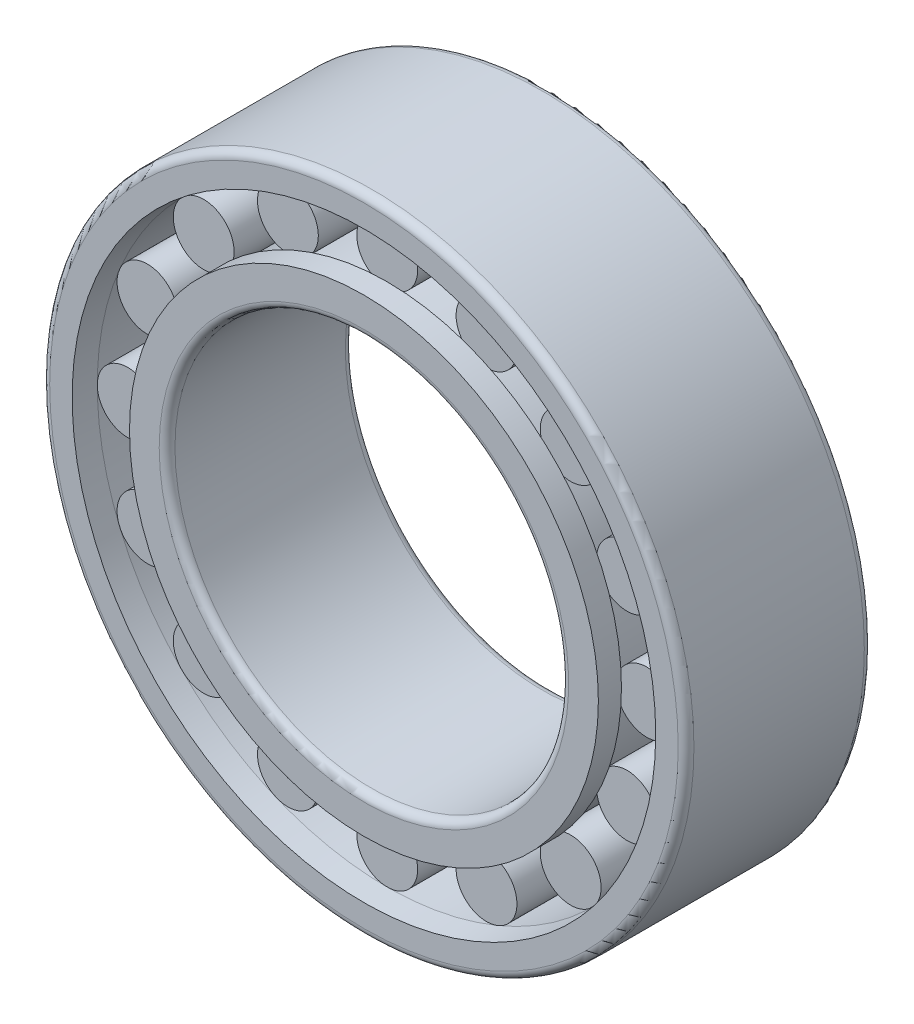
SolidWorks part; units mm, degrees
ref_plane "Front Plane" through (0, 0, 0) normal (0, 0, 1) x (1, 0, 0)
ref_plane "Top Plane" through (0, 0, 0) normal (0, 1, 0) x (1, 0, 0)
ref_plane "Right Plane" through (0, 0, 0) normal (1, 0, 0) x (0, 0, -1)
sketch "BaseSke" plane through (0, 0, 0) normal (1, 0, 0) x (0, 0, -1)
  line L0 (-47.2296, 0) -> (24.6132, 0) construction
  line L1 (-47.2296, 36.25) -> (24.6132, 36.25) construction
  line L2 (0, 129.5214) -> (0, -86.3012) construction
  line L3 (-9.75, 36.25) -> (-9.75, 32) construction
  line L4 (-13, 45) -> (13, 45) construction
  line L5 (-13, 27.5) -> (13, 27.5) construction
  line L6 (-9.75, 40.5) -> (-1.3, 40.5)
  line L7 (-9.75, 40.5) -> (-9.75, 36.25)
  line L8 (-9.75, 36.25) -> (-1.3, 36.25)
  line L9 (9.75, 40.5) -> (9.75, 36.25)
  line L10 (-9.75, 32) -> (9.75, 32) construction
  line L11 (9.75, 32) -> (9.75, 36.25) construction
  line L12 (-1.3, 40.5) -> (-1.3, 36.25)
  line L13 (1.3, 40.5) -> (1.3, 36.25)
  line L14 (1.3, 40.5) -> (9.75, 40.5)
  line L15 (1.3, 36.25) -> (9.75, 36.25)
  dimension "D2" = 19.5
  dimension "D1" = 36.25
  dimension "Bearing_Thickness" = 26
  dimension "Bearing_Outside_Diameter" = 90
  dimension "Bearing_Inside_Diameter" = 55
  dimension "Diameter_Ew" = 81
  dimension "D4" = 2.6
revolve "Roller" add sketch "BaseSke" angle 360 about L8
sketch "OuterRaceSke" plane through (0, 0, 0) normal (1, 0, 0) x (0, 0, -1)
  line L0 (0, 0) -> (0, 87.5396) construction
  line L1 (-13, 45) -> (13, 45)
  line L2 (-13, 45) -> (-13, 40.7622)
  line L3 (9.775, 40.48) -> (13, 40.7622)
  line L4 (13, 45) -> (13, 40.7622)
  line L5 (-50.3916, 0) -> (55.2197, 0) construction
  line L6 (-9.775, 40.48) -> (-13, 40.7622)
  line L9 (-9.75, 40.5) -> (-1.3, 40.5) construction
  line L10 (-9.775, 40.48) -> (9.775, 40.48)
  dimension "D1" = 19.55
  dimension "D2" = 5
  dimension "D3" = 0.02
revolve "OuterRace" add sketch "OuterRaceSke" angle 360 about L5
sketch "InnerRaceSke" plane through (0, 0, 0) normal (1, 0, 0) x (0, 0, -1)
  line L0 (-70.8626, 0) -> (113.5527, 0) construction
  line L1 (0, 58.441) -> (0, -70.8113) construction
  line L2 (-13, 27.5) -> (13, 27.5)
  line L3 (-13, 27.5) -> (-13, 32.75)
  line L4 (-9.775, 32.02) -> (9.775, 32.02)
  line L5 (-13, 32.75) -> (-9.775, 32.75)
  line L6 (0, 129.5214) -> (0, -86.3012) construction
  line L7 (-9.775, 32.75) -> (-9.775, 32.02)
  line L9 (13, 27.5) -> (13, 32.75)
  line L10 (9.775, 32.02) -> (9.775, 32.75)
  line L11 (9.775, 32.75) -> (13, 32.75)
  line L14 (-9.75, 32) -> (9.75, 32) construction
  point P17 (0, 27.5)
  dimension "D2" = 19.55
  dimension "D1" = 0.02
  dimension "D3" = 32.75
revolve "InnerRace" add sketch "InnerRaceSke" angle 360 about L0
fillet "Fillet1" radius 1.1 4 edges at (27.5, 0, 13) (45, 0, -13) (45, 0, 13) (27.5, 0, -13)
pattern_circular "CirPatternBall" count 16 over 360 about axis through (0, 0, 0) along (0, 0, 1) of "Roller"
sketch "CutGrooveSke" plane through (0, 0, 0) normal (1, 0, 0) x (0, 0, -1)
  line L0 (-51.8407, 0) -> (83.8302, 0) construction
  line L1 (-6.5, -64.1) -> (-7.8, -64.1)
  line L2 (-6.5, -64.1) -> (-6.5, -44.1)
  line L3 (-6.5, -44.1) -> (-7.8, -44.1)
  line L4 (-7.8, -64.1) -> (-7.8, -44.1)
  dimension "D1" = 44.1
  dimension "D2" = 6.5
  dimension "D3" = 1.3
  dimension "D4" = 20
revolve "CutGroove" [suppressed] cut sketch "CutGrooveSke" angle 360 about L0
sketch "TaperSke" plane through (0, 0, 0) normal (1, 0, 0) x (0, 0, -1)
  line L0 (-13, 27.5) -> (13, 27.5)
  line L1 (13, 27.5) -> (13, 29.6667)
  line L2 (13, 29.6667) -> (-13, 27.5)
  line L7 (-41.2502, 0) -> (40.8606, 0) construction
  dimension "Taper" = 2.1667
revolve "Taper" [suppressed] cut sketch "TaperSke" angle 360 about L7
fillet "Fillet2" [suppressed] radius 1.1
sketch "SimplifiedSke" plane through (0, 0, 0) normal (1, 0, 0) x (0, 0, -1)
  line L0 (37.5911, 0) -> (-37.5911, 0) construction
  line L1 (-13.1351, 36.25) -> (13.151, 36.25) construction
  line L2 (-9.75, 32) -> (9.75, 32)
  line L3 (-9.75, 32) -> (-9.75, 40.5)
  line L4 (-9.75, 40.5) -> (9.75, 40.5)
  line L5 (9.75, 32) -> (9.75, 40.5)
  line L6 (-47.2296, 36.25) -> (24.6132, 36.25) construction
revolve "Simplified" [suppressed] add sketch "SimplifiedSke" angle 360 about L0
equation "\"D1@BaseSke\" =  (\"Bearing_Outside_Diameter@BaseSke\"  +  \"Bearing_Inside_Diameter@BaseSke\"  )  / 4"
equation "\"D2@BaseSke\" = \"Bearing_Thickness@BaseSke\"*0.75"
equation "\"D4@BaseSke\" = \"Bearing_Thickness@BaseSke\"/10"
equation "\"D1@OuterRaceSke\" = \"Bearing_Thickness@BaseSke\"*0.75+0.05"
equation "\"D2@InnerRaceSke\" = \"D1@OuterRaceSke\""
equation "\"D3@InnerRaceSke\" = ( \"Bearing_Outside_Diameter@BaseSke\" - \"Bearing_Inside_Diameter@BaseSke\" )  / 2 * 0.3 + \"Bearing_Inside_Diameter@BaseSke\" / 2"
equation "\"D1@CirPatternBall\" =  int( \"D1@BaseSke\" *  pi  * 2 / ( \"Bearing_Outside_Diameter@BaseSke\" - \"Bearing_Inside_Diameter@BaseSke\" ) * 2.5   ) "
equation "\"D1@CutGrooveSke\" = \"Bearing_Outside_Diameter@BaseSke\" * 0.49"
equation "\"D2@CutGrooveSke\" = \"Bearing_Thickness@BaseSke\" *0.25"
equation "\"D3@CutGrooveSke\" = \"Bearing_Thickness@BaseSke\"/20"
equation "\"Taper@TaperSke\" = \"Bearing_Thickness@BaseSke\"/12"
equation "\"D1@Fillet2\" = \"Fillet_radius@Fillet1\""
